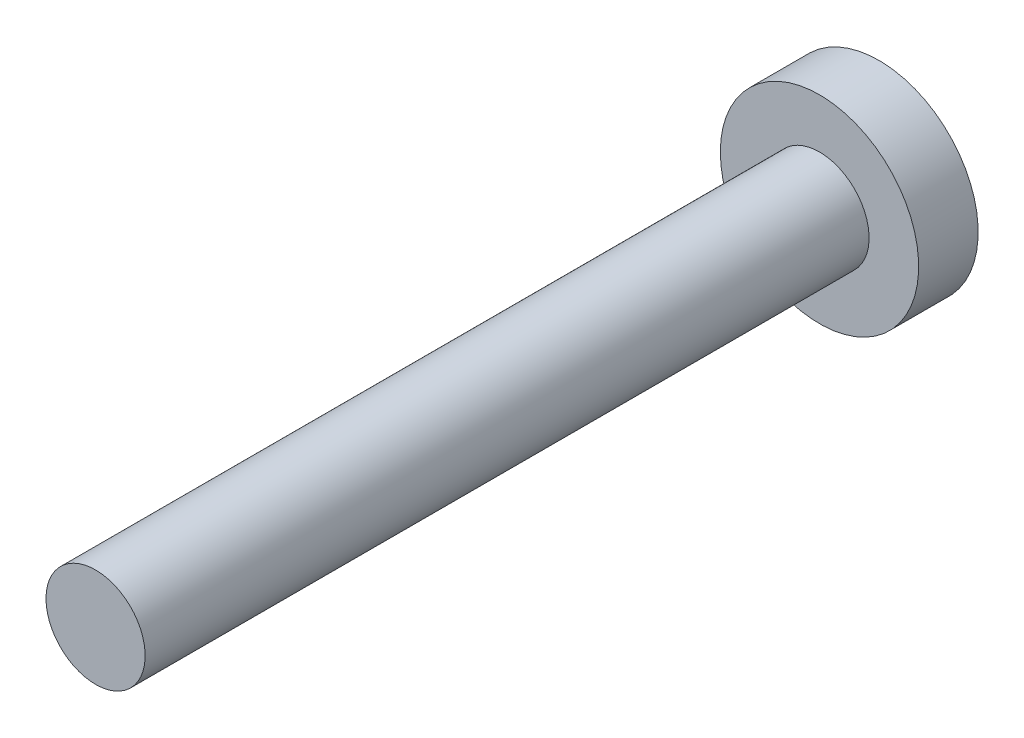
SolidWorks part; units mm, degrees
ref_plane "Face" through (0, 0, 0) normal (0, 0, 1) x (1, 0, 0)
ref_plane "Dessus" through (0, 0, 0) normal (0, 1, 0) x (1, 0, 0)
ref_plane "Droite" through (0, 0, 0) normal (1, 0, 0) x (0, 0, -1)
sketch "Esquisse1" plane through (0, 0, 0) normal (0, 0, 1) x (1, 0, 0)
  circle A0 centre (0, 0) radius 5
  dimension "D1" = 10
extrude "Extrusion1" add sketch "Esquisse1" along normal blind 3
sketch "Esquisse2" plane through (0, 0, 3) normal (0, 0, 1) x (1, 0, 0)
  circle A0 centre (0, 0) radius 2.5
  circle A1 centre (0, 0) radius 5 construction
  dimension "D1" = 5
extrude "Extrusion2" add sketch "Esquisse2" along normal blind 36.5
